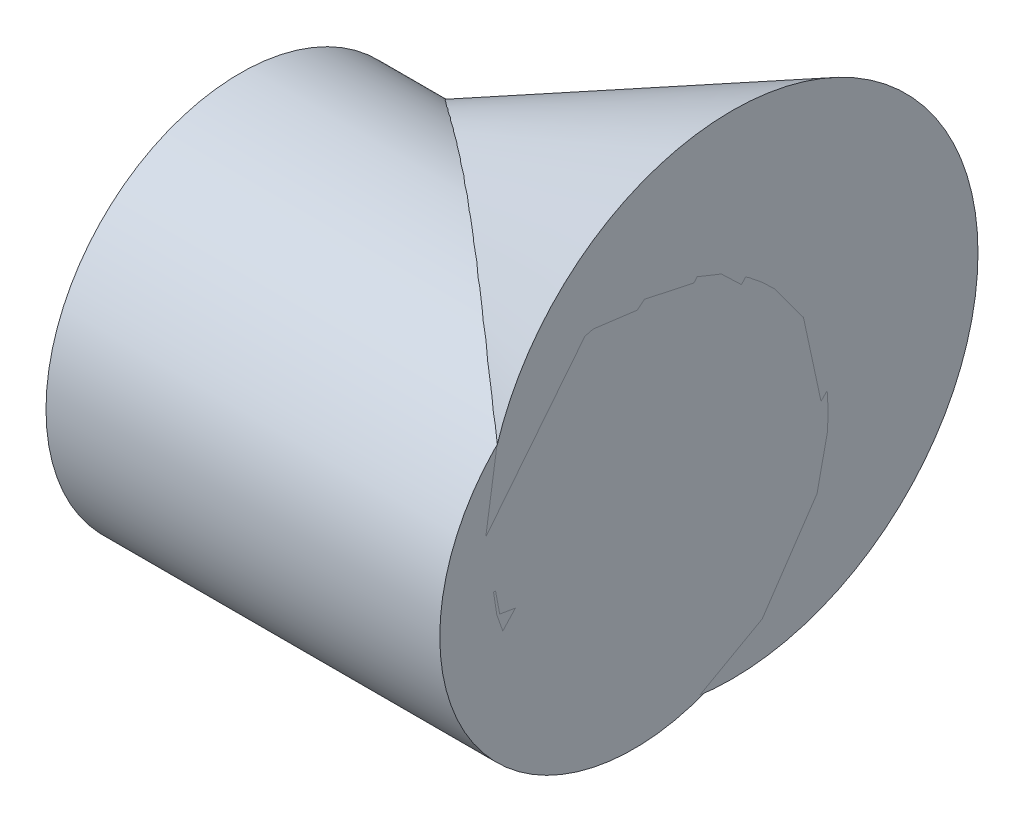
SolidWorks part; units mm, degrees
ref_plane "前视基准面" through (0, 0, 0) normal (0, 0, 1) x (1, 0, 0)
ref_plane "上视基准面" through (0, 0, 0) normal (0, 1, 0) x (1, 0, 0)
ref_plane "右视基准面" through (0, 0, 0) normal (1, 0, 0) x (0, 0, -1)
sketch "草图1" plane through (0, 0, 0) normal (0, 0, 1) x (1, 0, 0)
  line L0 (-69.2897, 0) -> (66.675, 0) construction
  line L1 (-47.9985, 0) -> (2.0015, 25)
  line L2 (2.0015, 25) -> (2.0015, 0)
  line L3 (-47.9985, 0) -> (2.0015, 0)
  dimension "D1" = 50
  dimension "D2" = 25
revolve "旋转1" add sketch "草图1" angle 360 about L0
sketch "草图3" plane through (2.0015, 0, 0) normal (1, 0, 0) x (0, 0, -1)
  circle A0 centre (-9.9481, -6.4398) radius 19.7236
extrude "拉伸1" add sketch "草图3" against normal blind 40 separate body
